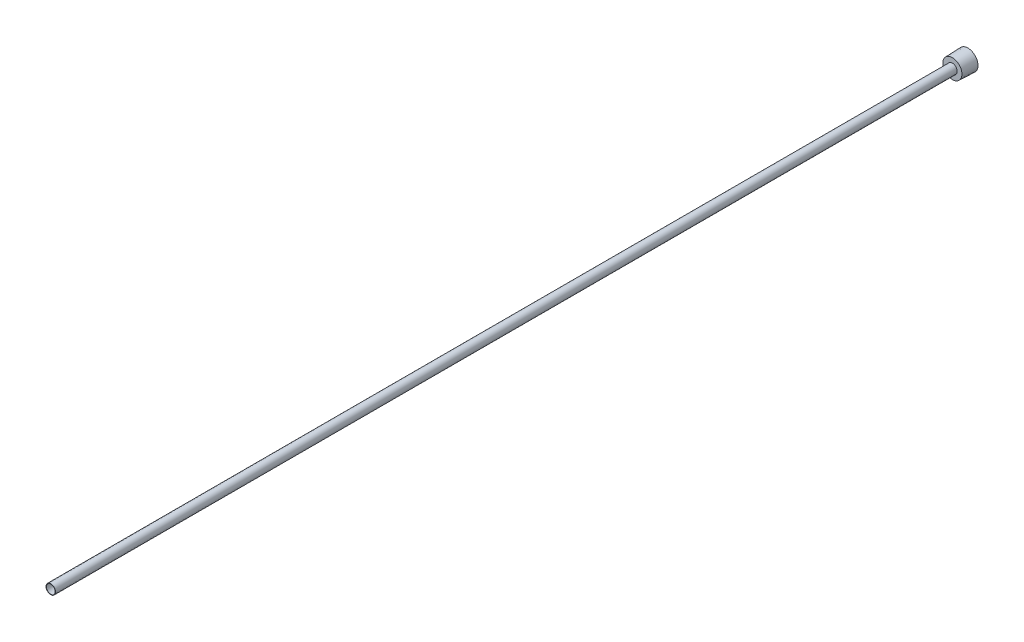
SolidWorks part; units mm, degrees
ref_plane "Front Plane" through (0, 0, 0) normal (0, 0, 1) x (1, 0, 0)
ref_plane "Top Plane" through (0, 0, 0) normal (0, 1, 0) x (1, 0, 0)
ref_plane "Right Plane" through (0, 0, 0) normal (1, 0, 0) x (0, 0, -1)
sketch "Sketch1" plane through (0, 0, 0) normal (1, 0, 0) x (0, 0, -1)
  line L0 (-331.1242, 0) -> (49668.8758, 0) construction
  line L1 (0, 0) -> (-609.6, 0)
  line L6 (0, 0) -> (0, 6.7183)
  line L7 (0, 6.7183) -> (-10.3124, 6.3421)
  line L8 (-10.3124, 3.175) -> (-609.6, 3.175)
  line L9 (-10.3124, 6.3421) -> (-10.3124, 3.175)
  line L10 (-609.6, 3.175) -> (-609.6, 0)
  dimension "D1" = 6.35
  dimension "D2" = 10.3124
  dimension "D3" = 2.089
  dimension "D4" = 13.4366
  dimension "D5" = 609.6
revolve "Revolve1" add sketch "Sketch1" angle 360 about L0
sketch "Sketch2" plane through (0, 0, 609.6) normal (0, 0, 1) x (1, 0, 0)
  circle A0 centre (0, 0) radius 2.921
  dimension "D1" = 5.842
extrude "Cut-Extrude1" cut sketch "Sketch2" against normal through all
sketch "Sketch3" plane through (0, 0, 0) normal (0, 0, -1) x (-1, 0, 0)
  line L0 (0, 7.3901) -> (0, -7.3901) construction
  line L1 (0, -3.6662) -> (3.175, -1.8331)
  line L2 (3.175, -1.8331) -> (3.175, 1.8331)
  line L3 (3.175, 1.8331) -> (0, 3.6662)
  line L4 (0, 3.6662) -> (-3.175, 1.8331)
  line L5 (-3.175, 1.8331) -> (-3.175, -1.8331)
  line L6 (-3.175, -1.8331) -> (0, -3.6662)
  circle A0 centre (0, 0) radius 3.175 construction
  dimension "D1" = 6.35
extrude "Cut-Extrude2" cut sketch "Sketch3" against normal blind 6.35
